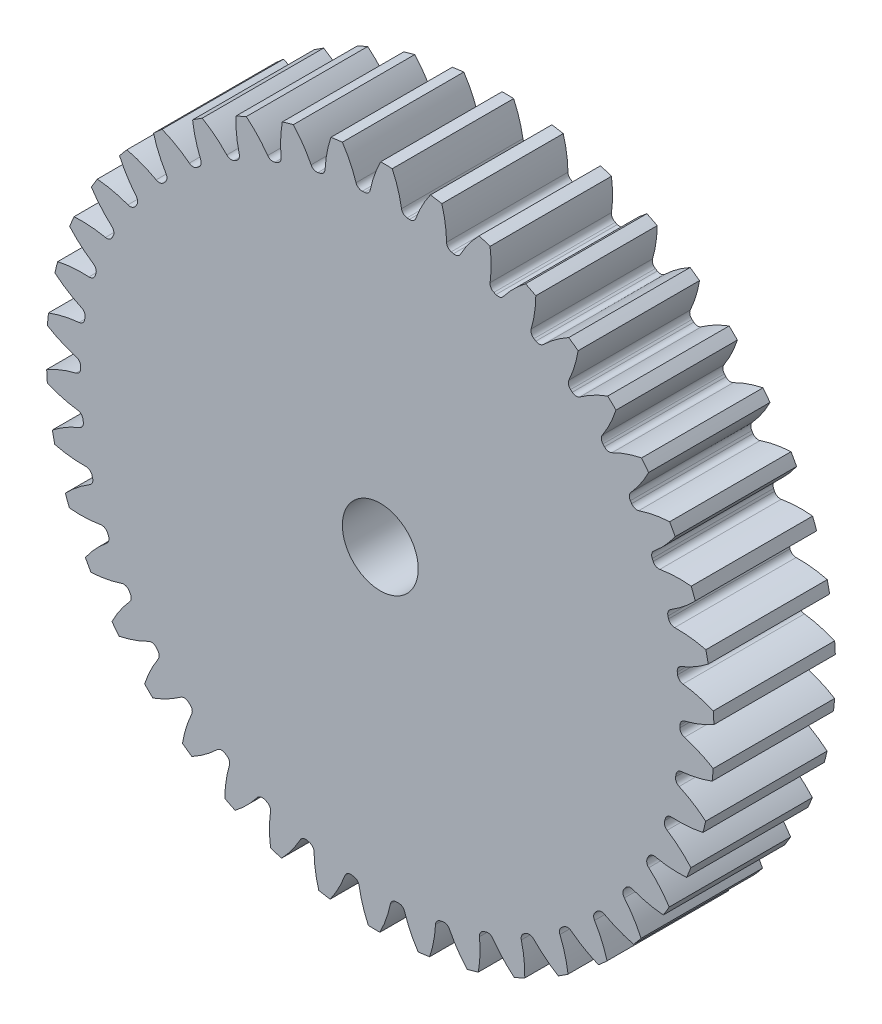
SolidWorks part; units mm, degrees
ref_plane "Front" through (0, 0, 0) normal (0, 0, 1) x (1, 0, 0)
ref_plane "Top" through (0, 0, 0) normal (0, 1, 0) x (1, 0, 0)
ref_plane "Right" through (0, 0, 0) normal (1, 0, 0) x (0, 0, -1)
sketch "Sketch3" plane through (0, 0, 0) normal (0, 0, 1) x (1, 0, 0)
  circle A0 centre (0, 0) radius 279.4
  dimension "od" = 558.8
extrude "gearBody" add sketch "Sketch3" along normal blind 101.6
sketch "Sketch2" plane through (0, 0, 0) normal (0, 0, 1) x (1, 0, 0)
  line L0 (0, 0) -> (231.539, 95.9066) construction
  line L1 (278.8008, -21.3504) -> (0, 0) construction
  line L2 (0, 0) -> (36.3143, 0) construction
  line L3 (266.6531, 5.001) -> (266.2853, -14.8662) construction
  line L5 (266.4692, -4.9326) -> (0, 0) construction
  line L7 (0, 0) -> (250.616, 0) construction
  arc A0 (250.6158, 0.3403) -> (250.4315, -9.6153) centre (0, 0) ccw construction
  arc A1 (279.1874, 10.898) -> (278.5928, -21.2231) centre (0, 0) ccw construction
  arc A2 (266.6531, 5.001) -> (266.2853, -14.8662) centre (0, 0) ccw construction
  arc A3 (250.7626, -5.5961) -> (250.7979, -3.6884) centre (0, 0) ccw
  arc A4 (278.8008, -21.3504) -> (254.5148, -10.6827) centre (227.8309, -104.41) ccw
  arc A5 (278.8008, -21.3504) -> (279.4, 11.0175) centre (0, 0) ccw
  arc A6 (279.4, 11.0175) -> (254.7358, 1.256) centre (231.539, 95.9066) cw
  arc A7 (250.7979, -3.6884) -> (254.7358, 1.256) centre (255.9662, -3.7644) cw
  arc A8 (254.5148, -10.6827) -> (250.7626, -5.5961) centre (255.9302, -5.7114) cw
  point P6 (279.4, 11.0175)
  point P22 (278.8008, -21.3504)
  dimension "baseDia" = 501.232
  dimension "od" = 558.8
  dimension "pd" = 533.4
  dimension "rd" = 501.65
  dimension "rFillet" = 5.1689
  dimension "pointX" = 279.4
  dimension "pointY" = 11.0175
  dimension "CTT" = 19.8672
  dimension "flankCenterAngle" = 22.5
extrude "toothCut" cut sketch "Sketch2" along normal through all
pattern_circular "CirPattern1" count 42 over 360 about axis through (0, 0, 0) along (0, 0, 1) of "toothCut"
sketch "hub1Dia" plane through (0, 0, 0) normal (0, 0, -1) x (-1, 0, 0)
  circle A0 centre (0, 0) radius 12.7
  dimension "hub1Dia" = 25.4
sketch "hub2Dia" plane through (0, 0, 101.6) normal (0, 0, 1) x (1, 0, 0)
  circle A0 centre (0, 0) radius 12.7
  dimension "hub2dia" = 25.4
sketch "boreDia" plane through (0, 0, 0) normal (0, 0, 1) x (1, 0, 0)
  circle A0 centre (0, 0) radius 31.75
  dimension "boreDia" = 63.5
extrude "bore" cut sketch "boreDia" against normal mid plane 25400
